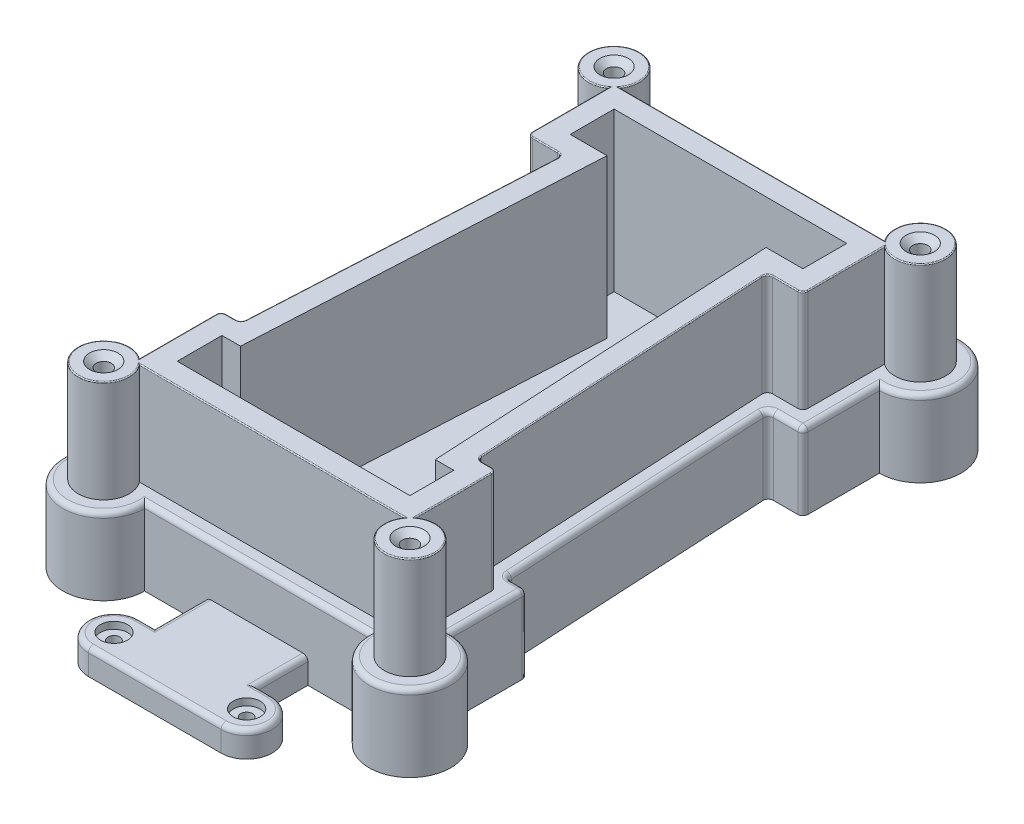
SolidWorks part; units mm, degrees
ref_plane "Front Plane" through (0, 0, 0) normal (0, 0, 1) x (1, 0, 0)
ref_plane "Top Plane" through (0, 0, 0) normal (0, 1, 0) x (1, 0, 0)
ref_plane "Right Plane" through (0, 0, 0) normal (1, 0, 0) x (0, 0, -1)
sketch "Sketch1" plane through (0, 0, 0) normal (0, 1, 0) x (1, 0, 0)
  line L0 (0, -63.5) -> (0, 63.5) construction
  line L1 (27.94, 63.5) -> (-27.94, 63.5)
  line L2 (-38.1, 53.34) -> (-38.1, 34.29)
  line L4 (-38.1, 34.29) -> (-29.4259, 34.29)
  line L5 (-38.1, 85.1067) -> (-38.1, 53.34) construction
  line L6 (-33.02, 0) -> (33.02, 0) construction
  line L7 (-38.1, -85.1067) -> (-38.1, -53.34) construction
  line L8 (-38.1, -34.29) -> (-33.02, -34.29)
  line L9 (-38.1, -53.34) -> (-38.1, -34.29)
  line L10 (27.94, -63.5) -> (-27.94, -63.5)
  line L11 (38.1, -85.1067) -> (38.1, -53.34) construction
  line L12 (38.1, 85.1067) -> (38.1, 53.34) construction
  line L13 (38.1, -53.34) -> (38.1, -34.29)
  line L14 (38.1, -34.29) -> (33.02, -34.29)
  line L15 (33.02, -34.29) -> (29.4259, 34.29)
  line L16 (38.1, 34.29) -> (29.4259, 34.29)
  line L17 (38.1, 53.34) -> (38.1, 34.29)
  line L18 (-33.02, -34.29) -> (-29.4259, 34.29)
  arc A0 (-27.94, 63.5) -> (-38.1, 53.34) centre (-38.1, 63.5) ccw
  arc A1 (-27.94, -63.5) -> (-38.1, -53.34) centre (-38.1, -63.5) cw
  arc A2 (27.94, -63.5) -> (38.1, -53.34) centre (38.1, -63.5) ccw
  arc A3 (27.94, 63.5) -> (38.1, 53.34) centre (38.1, 63.5) cw
  point P20 (0, 0)
  dimension "D2" = 10.16
  dimension "D1" = 127
  dimension "D3" = 38.1
  dimension "D4" = 19.05
  dimension "D5" = 87
  dimension "D6" = 93
  dimension "D7" = 68.58
  dimension "D8" = 8.6741
extrude "A1" add sketch "Sketch1" along normal blind 19.05
sketch "Sketch2" plane through (0, 0, 0) normal (0, -1, 0) x (1, 0, 0)
  line L1 (-12.7, 63.5) -> (-12.7, 76.2)
  line L2 (-27.94, 63.5) -> (27.94, 63.5) construction
  line L3 (-12.7, 76.2) -> (-16.51, 76.2)
  line L4 (-16.51, 88.9) -> (16.51, 88.9)
  line L5 (0, 0) -> (0, 123.1625) construction
  line L6 (-12.7, 63.5) -> (12.7, 63.5)
  line L7 (12.7, 76.2) -> (16.51, 76.2)
  line L8 (12.7, 63.5) -> (12.7, 76.2)
  arc A0 (-16.51, 76.2) -> (-16.51, 88.9) centre (-16.51, 82.55) cw
  arc A1 (16.51, 76.2) -> (16.51, 88.9) centre (16.51, 82.55) ccw
  point P14 (0, 88.9)
  dimension "D2" = 6.35
  dimension "D1" = 12.7
  dimension "D3" = 16.51
  dimension "D4" = 25.4
extrude "A2" add sketch "Sketch2" against normal blind 6.35
sketch "Sketch3" plane through (0, 19.05, 0) normal (0, 1, 0) x (1, 0, 0)
  line L24 (-34.29, 38.1) -> (-25.411, 38.1)
  line L25 (-34.29, 38.1) -> (-25.411, 38.1)
  line L26 (-25.411, 38.1) -> (-29.4044, -38.1)
  line L27 (-25.411, 38.1) -> (-29.4044, -38.1)
  line L30 (29.4044, -38.1) -> (25.411, 38.1)
  line L31 (29.4044, -38.1) -> (25.411, 38.1)
  line L36 (-34.29, 58.42) -> (-34.29, 38.1)
  line L39 (-29.4044, -38.1) -> (-34.29, -38.1)
  line L40 (-34.29, -38.1) -> (-34.29, -58.42)
  line L41 (-33.02, -59.69) -> (33.02, -59.69)
  line L42 (34.29, -58.42) -> (34.29, -38.1)
  line L43 (34.29, -38.1) -> (29.4044, -38.1)
  line L45 (25.411, 38.1) -> (34.29, 38.1)
  line L46 (34.29, 38.1) -> (34.29, 58.42)
  line L47 (33.02, 59.69) -> (-33.02, 59.69)
  line L48 (-34.29, 58.42) -> (-34.29, 38.1)
  line L51 (-29.4044, -38.1) -> (-34.29, -38.1)
  line L52 (-34.29, -38.1) -> (-34.29, -58.42)
  line L53 (-33.02, -59.69) -> (33.02, -59.69)
  line L54 (34.29, -58.42) -> (34.29, -38.1)
  line L55 (34.29, -38.1) -> (29.4044, -38.1)
  line L57 (25.411, 38.1) -> (34.29, 38.1)
  line L58 (34.29, 38.1) -> (34.29, 58.42)
  line L59 (33.02, 59.69) -> (-33.02, 59.69)
  arc A12 (-33.02, 59.69) -> (-34.29, 58.42) centre (-38.1, 63.5) ccw
  arc A13 (-34.29, -58.42) -> (-33.02, -59.69) centre (-38.1, -63.5) ccw
  arc A14 (33.02, -59.69) -> (34.29, -58.42) centre (38.1, -63.5) ccw
  arc A15 (34.29, 58.42) -> (33.02, 59.69) centre (38.1, 63.5) ccw
  arc A16 (-33.02, 59.69) -> (-34.29, 58.42) centre (-38.1, 63.5) ccw
  arc A17 (-34.29, -58.42) -> (-33.02, -59.69) centre (-38.1, -63.5) ccw
  arc A18 (33.02, -59.69) -> (34.29, -58.42) centre (38.1, -63.5) ccw
  arc A19 (34.29, 58.42) -> (33.02, 59.69) centre (38.1, 63.5) ccw
  dimension "D1" = 3.81
extrude "A3" add sketch "Sketch3" along normal blind 25.4
sketch "Sketch9" plane through (0, 44.45, 0) normal (0, 1, 0) x (1, 0, 0)
  line L0 (34.036, -58.9563) -> (34.036, -59.436)
  line L1 (34.036, -59.436) -> (33.5563, -59.436)
  line L2 (-33.5563, -59.436) -> (-34.036, -59.436)
  line L3 (-34.036, -59.436) -> (-34.036, -58.9563)
  line L4 (-33.5563, 59.436) -> (-34.036, 59.436)
  line L5 (-34.036, 59.436) -> (-34.036, 58.9563)
  line L6 (28.956, -54.356) -> (28.956, -54.356)
  line L7 (34.036, 59.436) -> (33.5563, 59.436)
  line L8 (34.036, 59.436) -> (34.036, 58.9563)
  line L9 (28.956, -54.356) -> (28.956, -54.356)
  line L10 (-28.956, -54.356) -> (28.956, -54.356)
  line L11 (-28.956, -54.356) -> (-28.956, -54.356)
  line L12 (25.411, 38.1) -> (34.29, 38.1)
  line L13 (25.411, 38.1) -> (34.29, 38.1)
  line L14 (34.29, 38.1) -> (34.29, 58.42)
  line L15 (34.29, 38.1) -> (34.29, 58.42)
  line L16 (33.02, 59.69) -> (-33.02, 59.69)
  line L17 (33.02, 59.69) -> (-33.02, 59.69)
  line L18 (-34.29, 58.42) -> (-34.29, 38.1)
  line L19 (-34.29, 58.42) -> (-34.29, 38.1)
  line L20 (-34.29, 38.1) -> (-25.411, 38.1)
  line L21 (-34.29, 38.1) -> (-25.411, 38.1)
  line L22 (-25.411, 38.1) -> (-29.4044, -38.1)
  line L23 (-25.411, 38.1) -> (-29.4044, -38.1)
  line L24 (-29.4044, -38.1) -> (-34.29, -38.1)
  line L25 (-29.4044, -38.1) -> (-34.29, -38.1)
  line L26 (-34.29, -38.1) -> (-34.29, -58.42)
  line L27 (-34.29, -38.1) -> (-34.29, -58.42)
  line L28 (-33.02, -59.69) -> (33.02, -59.69)
  line L29 (-33.02, -59.69) -> (33.02, -59.69)
  line L30 (34.29, -58.42) -> (34.29, -38.1)
  line L31 (34.29, -58.42) -> (34.29, -38.1)
  line L32 (34.29, -38.1) -> (29.4044, -38.1)
  line L33 (34.29, -38.1) -> (29.4044, -38.1)
  line L34 (29.4044, -38.1) -> (25.411, 38.1)
  line L35 (29.4044, -38.1) -> (25.411, 38.1)
  line L36 (-28.956, -54.356) -> (-28.956, -54.356)
  line L37 (-28.956, -43.2236) -> (-28.956, -54.356)
  line L38 (-28.956, -43.2236) -> (-28.956, -43.2236)
  line L39 (-20.1543, 36.4844) -> (-24.0147, -37.1756)
  line L40 (-28.956, 43.434) -> (-26.7493, 43.434)
  line L41 (-28.956, 54.356) -> (-28.956, 43.434)
  line L42 (-28.956, 54.356) -> (-28.956, 54.356)
  line L43 (-28.956, 54.356) -> (-28.956, 54.356)
  line L44 (28.956, 54.356) -> (-28.956, 54.356)
  line L45 (28.956, 54.356) -> (28.956, 54.356)
  line L46 (28.956, 54.356) -> (28.956, 54.356)
  line L47 (28.956, 43.434) -> (28.956, 54.356)
  line L48 (26.7493, 43.434) -> (28.956, 43.434)
  line L49 (24.3427, -43.434) -> (20.1543, 36.4844)
  line L50 (28.956, -43.434) -> (24.3427, -43.434)
  line L51 (28.956, -54.356) -> (28.956, -43.434)
  line L52 (-20.1543, 36.4844) -> (-19.7901, 43.434)
  line L53 (-19.7901, 43.434) -> (-26.7493, 43.434)
  line L54 (20.1543, 36.4844) -> (19.7901, 43.434)
  line L55 (19.7901, 43.434) -> (26.7493, 43.434)
  line L56 (-24.0147, -37.1756) -> (-24.3316, -43.2236)
  line L57 (-24.3316, -43.2236) -> (-28.956, -43.2236)
  line L70 (33.5563, 59.436) -> (-33.5563, 59.436) construction
  line L71 (-34.036, 58.9563) -> (-34.036, 39.37) construction
  line L72 (-33.02, 38.354) -> (-26.7493, 38.354) construction
  line L73 (-25.2274, 36.7502) -> (-29.0877, -36.9098) construction
  line L74 (-30.6096, -38.354) -> (-33.02, -38.354) construction
  line L75 (-34.036, -39.37) -> (-34.036, -58.9563) construction
  line L76 (-33.5563, -59.436) -> (33.5563, -59.436) construction
  line L77 (34.036, -58.9563) -> (34.036, -39.37) construction
  line L78 (33.02, -38.354) -> (29.1634, -38.354) construction
  line L79 (29.1634, -38.354) -> (25.2274, 36.7502) construction
  line L80 (26.7493, 38.354) -> (33.02, 38.354) construction
  line L81 (34.036, 39.37) -> (34.036, 58.9563) construction
  arc A0 (-28.956, -43.2236) -> (-28.956, -43.2236) centre (-28.956, -43.2236) ccw
  arc A3 (-28.956, 43.434) -> (-28.956, 43.434) centre (-28.956, 43.434) ccw
  arc A4 (28.956, 43.434) -> (28.956, 43.434) centre (28.956, 43.434) ccw
  arc A6 (28.956, -43.434) -> (28.956, -43.434) centre (28.956, -43.434) ccw
  arc A8 (34.29, 58.42) -> (33.02, 59.69) centre (38.1, 63.5) ccw
  arc A9 (34.29, 58.42) -> (33.02, 59.69) centre (38.1, 63.5) ccw
  arc A10 (-33.02, 59.69) -> (-34.29, 58.42) centre (-38.1, 63.5) ccw
  arc A11 (-33.02, 59.69) -> (-34.29, 58.42) centre (-38.1, 63.5) ccw
  arc A12 (-34.29, -58.42) -> (-33.02, -59.69) centre (-38.1, -63.5) ccw
  arc A13 (-34.29, -58.42) -> (-33.02, -59.69) centre (-38.1, -63.5) ccw
  arc A14 (33.02, -59.69) -> (34.29, -58.42) centre (38.1, -63.5) ccw
  arc A15 (33.02, -59.69) -> (34.29, -58.42) centre (38.1, -63.5) ccw
  arc A36 (-20.1543, 36.4844) -> (-26.7493, 43.434) centre (-26.7493, 36.83) ccw construction
  arc A37 (26.7493, 43.434) -> (20.1543, 36.4844) centre (26.7493, 36.83) ccw construction
  arc A38 (-28.956, -43.2236) -> (-24.0147, -37.1756) centre (-30.6096, -36.83) ccw construction
  arc A39 (-34.036, 39.37) -> (-33.02, 38.354) centre (-33.02, 39.37) ccw construction
  arc A40 (-25.2274, 36.7502) -> (-26.7493, 38.354) centre (-26.7493, 36.83) ccw construction
  arc A41 (-30.6096, -38.354) -> (-29.0877, -36.9098) centre (-30.6096, -36.83) ccw construction
  arc A42 (-33.02, -38.354) -> (-34.036, -39.37) centre (-33.02, -39.37) ccw construction
  arc A43 (34.036, -39.37) -> (33.02, -38.354) centre (33.02, -39.37) ccw construction
  arc A44 (26.7493, 38.354) -> (25.2274, 36.7502) centre (26.7493, 36.83) ccw construction
  arc A45 (33.02, 38.354) -> (34.036, 39.37) centre (33.02, 39.37) ccw construction
  dimension "D1" = 0
  dimension "D2" = 5.08
extrude "B1" cut sketch "Sketch9" against normal offset from surface (39.37 mm away) 5.08
hole_wizard "C1" positions "Sketch6" profile "Sketch5" countersink size "#6" standard "Ansi Inch"
sketch "Sketch6" plane through (0, 44.45, 0) normal (0, 1, 0) x (-1, 0, 0)
  arc A0 (33.02, -59.69) -> (34.29, -58.42) centre (38.1, -63.5) ccw construction
  point P0 (38.1, -63.5)
  point P1 (-38.1, -63.5)
  point P4 (-38.1, 63.5)
  point P7 (38.1, 63.5)
sketch "Sketch5" plane through (-38.1, 44.45, -63.5) normal (1, 0, 0) x (0, 0, 1)
  line L0 (0, 0) -> (0, 44.45)
  line L1 (0, 44.45) -> (1.8986, 44.45)
  line L2 (1.8986, 44.45) -> (1.8986, 1.38)
  line L3 (1.8986, 1.38) -> (3.5433, 0)
  line L5 (3.5433, 0) -> (0, 0)
  line L6 (-1.8986, 1.38) -> (-3.5433, 0) construction
  line L11 (0, -6.35) -> (0, 107.95) construction
  dimension "Thru Hole Dia." = 3.7973
  dimension "Thru Hole Depth" = 44.45
  dimension "Near C'Sink Dia." = 7.0866
  dimension "Near C'Sink Angle" = 100
hole_wizard "C2" positions "Sketch8" profile "Sketch7" counterbore size "#4" standard "Ansi Inch"
sketch "Sketch8" plane through (0, 6.35, 0) normal (0, 1, 0) x (-1, 0, 0)
  arc A0 (16.51, 76.2) -> (16.51, 88.9) centre (16.51, 82.55) ccw construction
  arc A1 (-16.51, 88.9) -> (-16.51, 76.2) centre (-16.51, 82.55) ccw construction
  point P0 (16.51, 82.55)
  point P1 (-16.51, 82.55)
sketch "Sketch7" plane through (-16.51, 6.35, 82.55) normal (1, 0, 0) x (0, 0, 1)
  line L0 (0, 0) -> (0, 6.35)
  line L1 (0, 6.35) -> (1.4732, 6.35)
  line L3 (1.4732, 6.35) -> (1.4732, 1.7272)
  line L4 (1.4732, 1.7272) -> (3.3731, 1.7272)
  line L5 (3.3731, 1.7272) -> (3.3731, 0)
  line L7 (3.3731, 0) -> (0, 0)
  line L11 (0, -6.35) -> (0, 107.95) construction
  dimension "Thru Hole Dia." = 2.9464
  dimension "Thru Hole Depth" = 6.35
  dimension "C'Bore Dia." = 6.7462
  dimension "C'Bore Depth" = 1.7272
fillet "D2" radius 1.27 16 edges at (-38.1, 9.525, 34.29) (-34.29, 31.75, 38.1) (34.29, 31.75, 38.1) (38.1, 9.525, 34.29) (38.1, 9.525, -34.29) (34.29, 31.75, -38.1) (29.4259, 9.525, -34.29) (25.411, 31.75, -38.1) (-29.4259, 9.525, -34.29) (-25.411, 31.75, -38.1) (-34.29, 31.75, -38.1) (-38.1, 9.525, -34.29) (-29.4044, 31.75, 38.1) (-33.02, 9.525, 34.29) (33.02, 9.525, 34.29) (29.4044, 31.75, 38.1)
fillet "D3" radius 1.27 31 edges at (-38.1, 19.05, -44.45) (-35.5276, 19.05, 34.29) (-37.728, 19.05, 34.662) (38.1, 19.05, -44.45) (37.728, 19.05, -34.662) (35.5276, 19.05, 34.29) (37.728, 19.05, 34.662) (14.605, 6.35, 76.2) (22.86, 6.35, 82.55) (-14.605, 6.35, 76.2) (-22.86, 6.35, 82.55) (0, 19.05, -63.5) (-45.2842, 19.05, -70.6842) (-38.1, 19.05, 44.45) (-45.2842, 19.05, 70.6842) (45.2842, 19.05, -70.6842) (33.7971, 19.05, -34.29) (38.1, 19.05, 44.45) (45.2842, 19.05, 70.6842) (0, 19.05, 63.5) (-12.7, 6.35, 69.85) (12.7, 6.35, 69.85) (0, 6.35, 88.9) (31.2264, 19.05, 0.0665) (-37.728, 19.05, -34.662) (-33.7971, 19.05, -34.29) (-29.8429, 19.05, -33.8942) (-31.2264, 19.05, 0.0665) (-33.351, 19.05, 33.9412) (29.8429, 19.05, -33.8942) (33.351, 19.05, 33.9412)
fillet "D4" radius 0.254 24 edges at (-42.5901, 44.45, -67.9901) (0, 44.45, -59.69) (42.5901, 44.45, -67.9901) (34.29, 44.45, -48.895) (33.918, 44.45, -38.472) (29.8846, 44.45, -38.1) (31.8148, 44.45, 38.1) (33.918, 44.45, 38.472) (34.29, 44.45, 48.895) (42.5901, 44.45, 67.9901) (0, 44.45, 59.69) (-42.5901, 44.45, 67.9901) (-34.29, 44.45, 48.895) (-33.918, 44.45, 38.472) (-31.8148, 44.45, 38.1) (-34.29, 44.45, -48.895) (27.4112, 44.45, 0.0665) (-27.4112, 44.45, 0.0665) (-29.8846, 44.45, -38.1) (25.828, 44.45, -37.7042) (-29.7354, 44.45, 37.7512) (-25.828, 44.45, -37.7042) (-33.918, 44.45, -38.472) (29.7354, 44.45, 37.7512)
